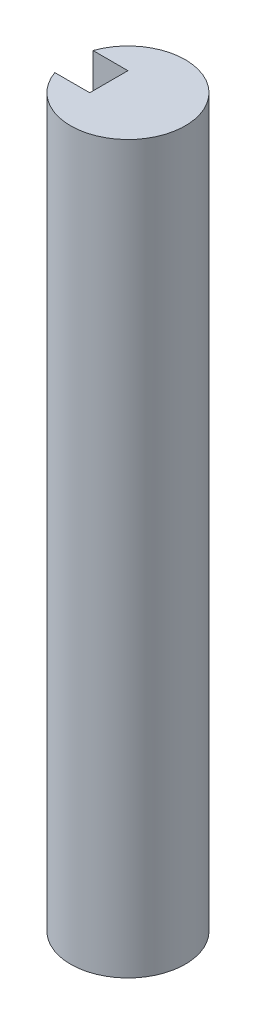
SolidWorks part; units mm, degrees
other "DetailItem3"
other "DetailItem4"
other "DetailItem5"
other "DetailItem6"
other "DetailItem7"
other "DetailItem8"
other "DetailItem9"
other "DetailItem10"
other "DetailItem11"
ref_plane "Front Plane" through (0, 0, 0) normal (0, 0, 1) x (1, 0, 0)
ref_plane "Top Plane" through (0, 0, 0) normal (0, 1, 0) x (1, 0, 0)
ref_plane "Right Plane" through (0, 0, 0) normal (1, 0, 0) x (0, 0, -1)
sketch "Sketch4" plane through (0, 0, 0) normal (1, 0, 0) x (0, 0, -1)
  line L0 (0, 0) -> (0, 3)
  line L1 (0, 3) -> (0, 4.5)
  line L2 (0, 4.5) -> (0, 6)
  line L3 (0, 6) -> (0, 7.5)
  line L4 (0, 7.5) -> (0, 9)
  line L5 (0, 9) -> (0, 10.5)
  line L6 (0, 10.5) -> (0, 12)
  line L7 (0, 12) -> (0, 13.5)
  line L8 (0, 13.5) -> (0, 15.5)
  line L9 (0, 15.5) -> (0, 17.5)
  line L10 (0, 17.5) -> (0, 19)
  line L11 (-1.5, 13.5) -> (1.5, 13.5)
  line L12 (-1.5, 17.5) -> (1.5, 17.5)
  line L13 (0, 19) -> (0, 20.5)
  line L14 (0, 20.5) -> (0, 22)
  line L15 (0, 22) -> (0, 25)
  line L16 (0, 0) -> (0, -3)
  line L17 (0, -3) -> (0, -4.5)
  line L18 (0, -4.5) -> (0, -6)
  line L19 (-1.5, -3) -> (1.5, -3)
  line L20 (-1.5, 3) -> (1.5, 3)
  dimension "D1" = 3
  dimension "D2" = 1.5
  dimension "D3" = 2
  dimension "D4" = 2
  dimension "D5" = 1.5
  dimension "D6" = 3
  dimension "D7" = 3
  dimension "D8" = 1.5
sketch "Sketch3" plane through (0, 0, 0) normal (0, 1, 0) x (1, 0, 0)
  circle A0 centre (1.5, 0) radius 1.5
  dimension "D1" = 3
extrude "Boss-Extrude2" add sketch "Sketch3" along normal up to vertex (19 mm away) contours A0
sketch "Sketch6" plane through (0, 0, 0) normal (1, 0, 0) x (0, 0, -1)
  line L1 (0, 9) -> (0, 10.5) construction
  line L2 (0.5, 12) -> (-0.5, 12)
  line L3 (0.5, 12) -> (0.5, 13.5)
  line L4 (0.5, 13.5) -> (-0.5, 13.5)
  line L5 (-0.5, 12) -> (-0.5, 13.5)
  line L6 (0.5, 12) -> (-0.5, 13.5) construction
  line L7 (0.5, 13.5) -> (-0.5, 12) construction
  line L8 (0.5, 9) -> (-0.5, 9)
  line L9 (0.5, 9) -> (0.5, 10.5)
  line L10 (0.5, 10.5) -> (-0.5, 10.5)
  line L11 (-0.5, 9) -> (-0.5, 10.5)
  line L12 (0.5, 9) -> (-0.5, 10.5) construction
  line L13 (0.5, 10.5) -> (-0.5, 9) construction
  line L14 (-0.5, 19) -> (0.5, 19)
  line L15 (-0.5, 19) -> (-0.5, 17.5)
  line L16 (-0.5, 17.5) -> (0.5, 17.5)
  line L17 (0.5, 19) -> (0.5, 17.5)
  line L18 (-0.5, 19) -> (0.5, 17.5) construction
  line L19 (-0.5, 17.5) -> (0.5, 19) construction
  point P0 (0, 12.75)
  point P7 (0, 9.75)
  point P12 (0, 18.25)
  dimension "D1" = 1
  dimension "D2" = 1
extrude "Cut-Extrude2" cut sketch "Sketch6" along normal blind 1 contours L11 L8 L9 L10
